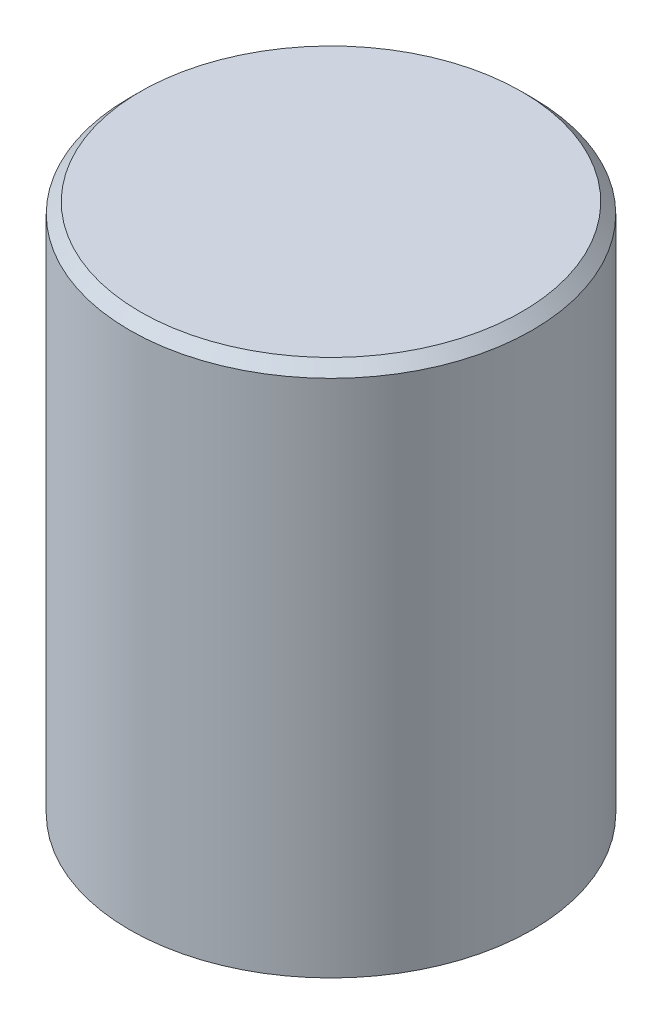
SolidWorks part; units mm, degrees
ref_plane "Front Plane" through (0, 0, 0) normal (0, 0, 1) x (1, 0, 0)
ref_plane "Top Plane" through (0, 0, 0) normal (0, 1, 0) x (1, 0, 0)
ref_plane "Right Plane" through (0, 0, 0) normal (1, 0, 0) x (0, 0, -1)
sketch "Sketch2" plane through (0, 0, 0) normal (0, 0, 1) x (1, 0, 0)
  line L0 (0, 0) -> (-19, 0) construction
  line L1 (-19, 0) -> (-17, 0)
  line L2 (-17, 0) -> (-17, 2)
  line L3 (-17, 2) -> (-14, 2)
  line L4 (-19, 0) -> (-19, 50)
  line L5 (-19, 50) -> (0, 50)
  line L6 (-14, 2) -> (-14, 45)
  line L7 (-14, 45) -> (0, 45)
  line L8 (0, 50) -> (0, 45)
  line L9 (0, 0) -> (0, 50000) construction
  dimension "D1" = 19
  dimension "D2" = 2
  dimension "D3" = 2
  dimension "D4" = 3
  dimension "D5" = 5
  dimension "D6" = 50
revolve "Revolve1" add sketch "Sketch2" angle 360 about L9
chamfer "Chamfer1" distance 1 angle 45 1 edges at (0, 50, -19)
